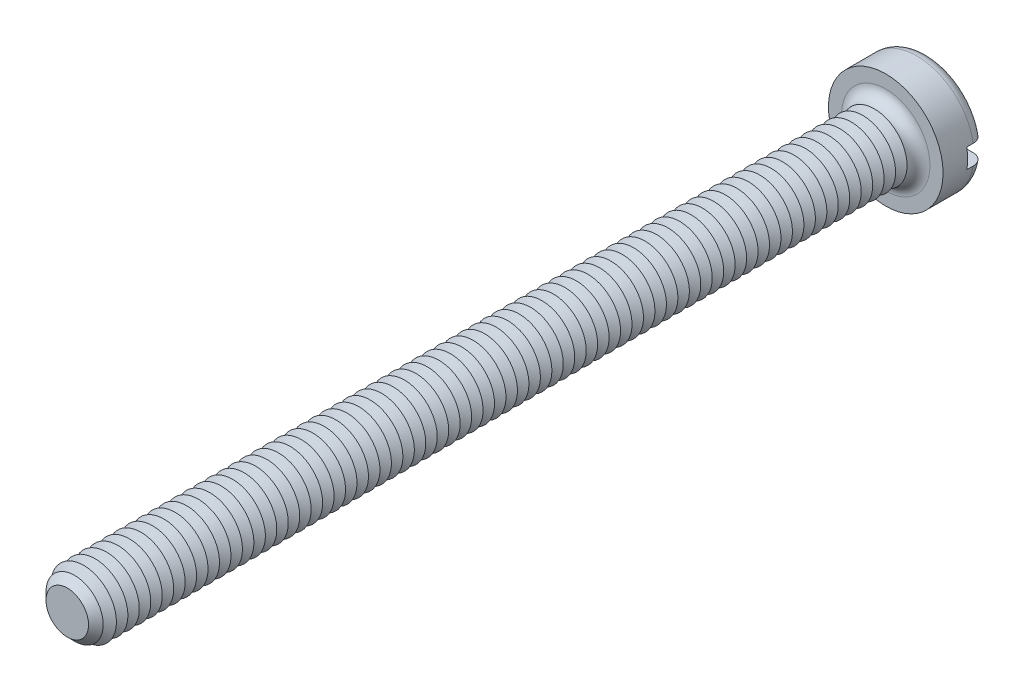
SolidWorks part; units mm, degrees
ref_plane "Front Plane" through (0, 0, 0) normal (0, 0, 1) x (1, 0, 0)
ref_plane "Top Plane" through (0, 0, 0) normal (0, 1, 0) x (1, 0, 0)
ref_plane "Right Plane" through (0, 0, 0) normal (1, 0, 0) x (0, 0, -1)
sketch "Sketch3" plane through (0, 0, 0) normal (0, 0, 1) x (1, 0, 0)
  circle A0 centre (0, 0) radius 3.5
  dimension "D1" = 7
extrude "Boss-Extrude2" add sketch "Sketch3" against normal blind 2.6
sketch "Sketch4" plane through (0, 0, 0) normal (0, 0, 1) x (1, 0, 0)
  circle A0 centre (0, 0) radius 2
  dimension "D1" = 4
extrude "Boss-Extrude3" add sketch "Sketch4" along normal blind 50
fillet "Fillet1" radius 0.7 2 edges at (3.5, 0, -2.6) (2, 0, 0)
chamfer "Chamfer1" distance 0.7 angle 45 1 edges at (2, 0, 50)
sketch "Sketch5" plane through (0, 0, 0) normal (1, 0, 0) x (0, 0, -1)
  line L0 (1.6944, 0) -> (-7.6738, 0) construction
sketch "Sketch6" plane through (0, 0, 0) normal (1, 0, 0) x (0, 0, -1)
  line L0 (-0.7, 2) -> (-1.05, 1.3938)
  line L1 (-1.05, 1.3938) -> (-1.4, 2)
  line L2 (-0.7, 2) -> (-49.3, 2) construction
  line L3 (-1.4, 2) -> (-0.7, 2)
  dimension "D1" = 0.7
revolve "Cut-Revolve1" cut sketch "Sketch6" angle 360 about L0
pattern_linear "LPattern1" count 70 spacing 0.7 along (0, 0, 1) of "Cut-Revolve1"
sketch "Sketch8" plane through (0, 0, -2.6) normal (0, 0, -1) x (-1, 0, 0)
  line L1 (3.5, -0.6) -> (-3.5, -0.6)
  line L2 (3.5, -0.6) -> (3.5, 0.6)
  line L3 (3.5, 0.6) -> (-3.5, 0.6)
  line L4 (-3.5, -0.6) -> (-3.5, 0.6)
  line L5 (3.5, -0.6) -> (-3.5, 0.6) construction
  line L6 (3.5, 0.6) -> (-3.5, -0.6) construction
  point P0 (0, 0)
  dimension "D1" = 7
  dimension "D2" = 1.2
extrude "Cut-Extrude1" cut sketch "Sketch8" against normal blind 1.1
